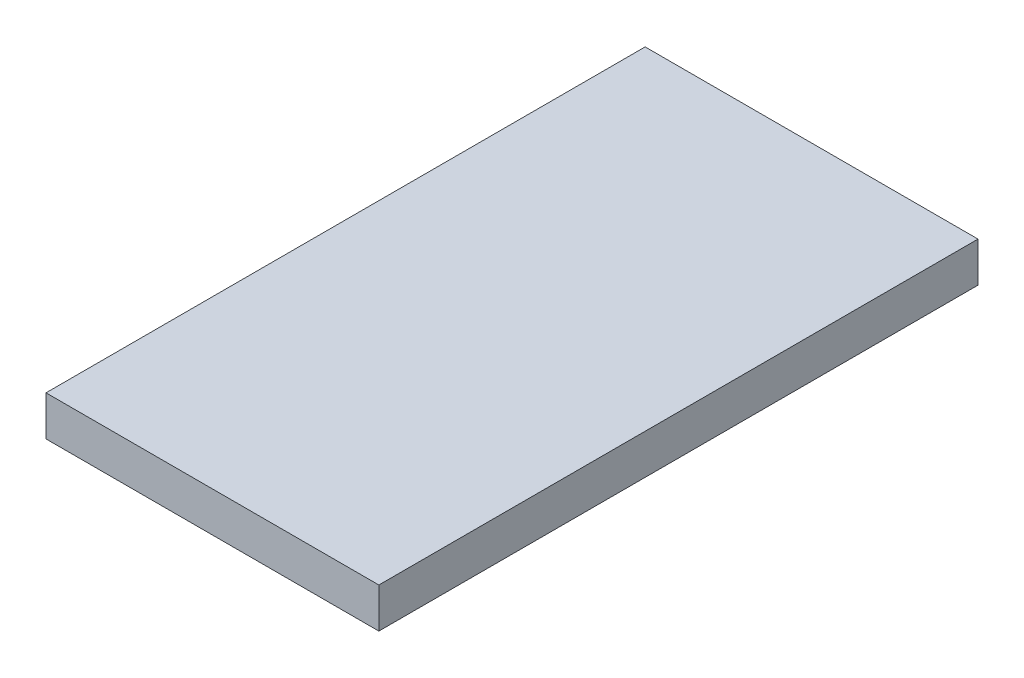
SolidWorks part; units mm, degrees
ref_plane "Ebene vorne" through (0, 0, 0) normal (0, 0, 1) x (1, 0, 0)
ref_plane "Ebene oben" through (0, 0, 0) normal (0, 1, 0) x (1, 0, 0)
ref_plane "Ebene rechts" through (0, 0, 0) normal (1, 0, 0) x (0, 0, -1)
sketch "Skizze1" plane through (0, 0, 0) normal (0, 1, 0) x (1, 0, 0)
  line L1 (0, 0) -> (-50, 0)
  line L2 (0, 0) -> (0, 90)
  line L3 (0, 90) -> (-50, 90)
  line L4 (-50, 0) -> (-50, 90)
  dimension "D1" = 50
  dimension "D2" = 90
extrude "Aufsatz-Linear austragen1" add sketch "Skizze1" along normal blind 6
